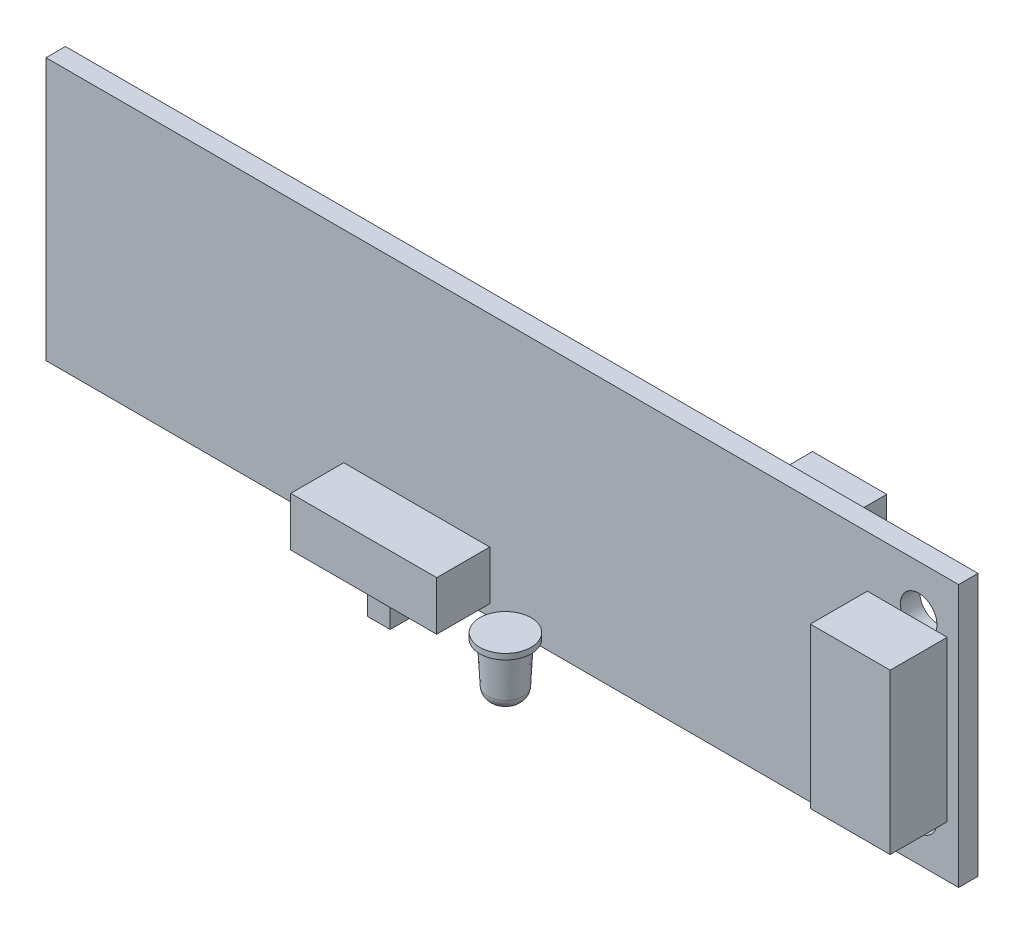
SolidWorks part; units mm, degrees
ref_plane "Front" through (0, 0, 0) normal (0, 0, 1) x (1, 0, 0)
ref_plane "Top" through (0, 0, 0) normal (0, 1, 0) x (1, 0, 0)
ref_plane "Right" through (0, 0, 0) normal (1, 0, 0) x (0, 0, -1)
sketch "Esquisse1" plane through (0, 0, 0) normal (0, 0, 1) x (1, 0, 0)
  line L1 (-40, 11.5) -> (40, 11.5)
  line L2 (-40, 11.5) -> (-40, -11.5)
  line L3 (-40, -11.5) -> (40, -11.5)
  line L4 (40, 11.5) -> (40, -11.5)
  line L5 (-40, 11.5) -> (40, -11.5) construction
  line L6 (-40, -11.5) -> (40, 11.5) construction
  point P0 (0, 0)
  dimension "D1" = 23
  dimension "D2" = 80
extrude "Boss.-Extru.1" add sketch "Esquisse1" along normal blind 1.7
sketch "Esquisse2" plane through (0, 0, 1.7) normal (0, 0, 1) x (1, 0, 0)
  line L0 (0, 0) -> (40, 0) construction
  line L1 (40, -11.5) -> (40, 11.5) construction
  line L2 (36.5, 0) -> (36.5, 7.5) construction
  circle A0 centre (36.5, 7.5) radius 1.6
  circle A1 centre (36.5, -7.5) radius 1.6
  dimension "D1" = 3.2
  dimension "D2" = 7.5
  dimension "D3" = 3.5
extrude "Enlèv. mat.-Extru.1" cut sketch "Esquisse2" against normal up to next
sketch "Esquisse3" plane through (0, 0, 1.7) normal (0, 0, 1) x (1, 0, 0)
  line L0 (0, 0) -> (0, 11.5) construction
  line L1 (40, 11.5) -> (-40, 11.5) construction
  line L2 (-40, 11.5) -> (-40, -11.5) construction
  line L3 (-13.9, -6.2) -> (-1.1, -6.2)
  line L4 (-13.9, -6.2) -> (-13.9, -10.5)
  line L5 (-13.9, -10.5) -> (-1.1, -10.5)
  line L6 (-1.1, -6.2) -> (-1.1, -10.5)
  line L7 (-13.9, -6.2) -> (-1.1, -10.5) construction
  line L8 (-13.9, -10.5) -> (-1.1, -6.2) construction
  line L9 (-40, -11.5) -> (40, -11.5) construction
  point P5 (-7.5, -8.35)
  dimension "D1" = 12.8
  dimension "D2" = 4.3
  dimension "D3" = 1
  dimension "D4" = 26.1
extrude "Boss.-Extru.2" add sketch "Esquisse3" along normal blind 4.65
sketch "Esquisse4" plane through (0, 0, 0) normal (0, 0, -1) x (-1, 0, 0)
  line L0 (0, 0) -> (-40, 0) construction
  line L1 (-40, -11.5) -> (-40, 11.5) construction
  line L3 (-18.5, -6.5) -> (-25, -6.5)
  line L4 (-18.5, -6.5) -> (-18.5, 6.5)
  line L5 (-18.5, 6.5) -> (-25, 6.5)
  line L6 (-25, -6.5) -> (-25, 6.5)
  line L7 (-18.5, -6.5) -> (-25, 6.5) construction
  line L8 (-18.5, 6.5) -> (-25, -6.5) construction
  point P5 (-21.75, 0)
  dimension "D1" = 6.5
  dimension "D2" = 13
  dimension "D3" = 15
extrude "Boss.-Extru.3" add sketch "Esquisse4" along normal blind 1
sketch "Esquisse5" plane through (0, 0, -1) normal (0, 0, -1) x (-1, 0, 0)
  line L0 (-18.5, -6.5) -> (-18.5, 6.5) construction
  line L1 (-18.5, -6.5) -> (-25, -6.5)
  line L2 (-18.5, -6.5) -> (-18.5, -2.5)
  line L3 (-18.5, -2.5) -> (-25, -2.5)
  line L4 (-25, -6.5) -> (-25, -2.5)
  line L5 (-18.5, -6.5) -> (-18.5, 6.5) construction
  line L6 (-25, 6.5) -> (-25, -6.5) construction
  line L7 (-18.5, 0) -> (-25, 0) construction
  line L8 (-25, 6.5) -> (-25, -6.5) construction
  line L9 (-25, 6.5) -> (-25, 2.5)
  line L10 (-18.5, 2.5) -> (-25, 2.5)
  line L11 (-18.5, 6.5) -> (-18.5, 2.5)
  line L12 (-18.5, 6.5) -> (-25, 6.5)
  dimension "D1" = 4
extrude "Boss.-Extru.4" add sketch "Esquisse5" along normal blind 6
ref_plane "Plan1" through (0, -9.5, 0) normal (0, -1, 0) x (-1, 0, 0)
sketch "Esquisse6" plane through (0, -9.5, 0) normal (0, -1, 0) x (-1, 0, 0)
  line L0 (1.1, -6.35) -> (1.1, -1.7) construction
  line L1 (40, -1.7) -> (-40, -1.7) construction
  circle A0 centre (-3.275, -4.7) radius 1.75
  dimension "D1" = 3.5
  dimension "D2" = 4.375
  dimension "D3" = 3
extrude "Boss.-Extru.5" add sketch "Esquisse6" along normal blind 4.5 draft 3 separate body
sketch "Esquisse7" plane through (0, -9.5, 0) normal (0, 1, 0) x (1, 0, 0)
  circle A0 centre (3.275, -4.7) radius 2.25
  dimension "D1" = 4.5
extrude "Boss.-Extru.6" add sketch "Esquisse7" along normal blind 0.5
fillet "Congé1" radius 1 1 edges at (3.275, -14, 3.1858)
sketch "Esquisse8" plane through (0, -10.5, 0) normal (0, -1, 0) x (1, 0, 0)
  line L0 (-13.9, 4.025) -> (-1.1, 4.025) construction
  line L1 (-8.5, 5.025) -> (-6.5, 5.025)
  line L2 (-8.5, 5.025) -> (-8.5, 3.025)
  line L3 (-8.5, 3.025) -> (-6.5, 3.025)
  line L4 (-6.5, 5.025) -> (-6.5, 3.025)
  line L5 (-8.5, 5.025) -> (-6.5, 3.025) construction
  line L6 (-8.5, 3.025) -> (-6.5, 5.025) construction
  line L7 (-13.9, 6.35) -> (-13.9, 1.7) construction
  line L8 (-1.1, 6.35) -> (-1.1, 1.7) construction
  line L9 (-7.5, 6.35) -> (-7.5, 1.7) construction
  line L10 (-13.9, 6.35) -> (-1.1, 6.35) construction
  line L11 (-13.9, 1.7) -> (-1.1, 1.7) construction
  point P0 (-7.5, 4.025)
  dimension "D1" = 2
  dimension "D2" = 2
extrude "Boss.-Extru.7" add sketch "Esquisse8" along normal blind 3
sketch "Esquisse9" plane through (0, 0, 1.7) normal (0, 0, 1) x (1, 0, 0)
  line L0 (0, 0) -> (40, 0) construction
  line L1 (40, -11.5) -> (40, 11.5) construction
  line L3 (32, 7) -> (39, 7)
  line L4 (32, 7) -> (32, -7)
  line L5 (32, -7) -> (39, -7)
  line L6 (39, 7) -> (39, -7)
  line L7 (32, 7) -> (39, -7) construction
  line L8 (32, -7) -> (39, 7) construction
  point P5 (35.5, 0)
  point P10 (30.7212, 0)
  dimension "D1" = 14
  dimension "D2" = 7
  dimension "D3" = 1
extrude "Boss.-Extru.8" add sketch "Esquisse9" along normal blind 5
